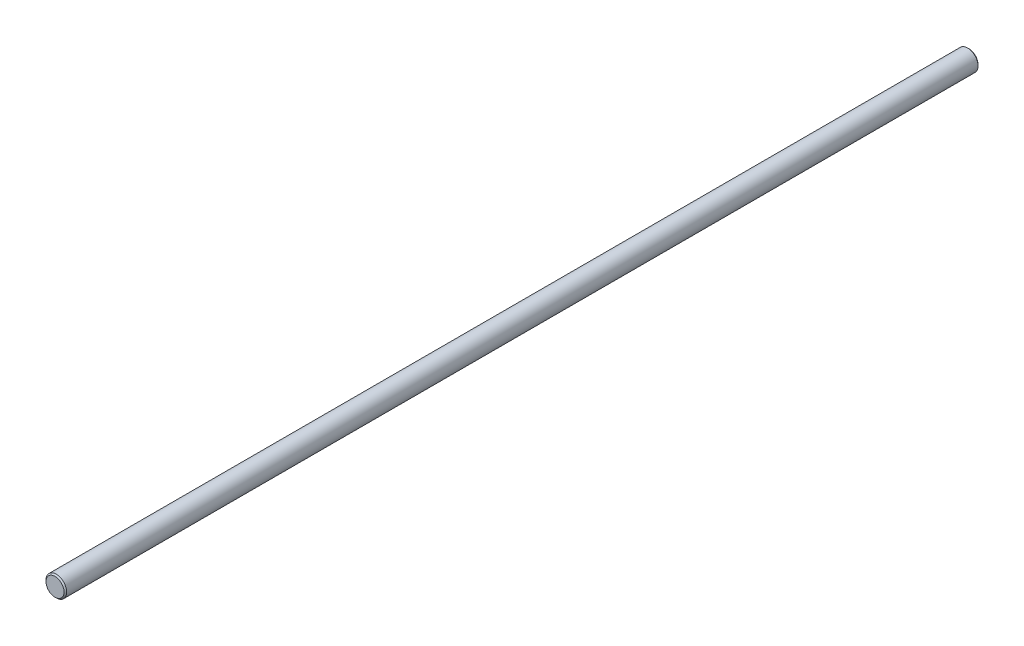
SolidWorks part; units mm, degrees
ref_plane "Спереди" through (0, 0, 0) normal (0, 0, 1) x (1, 0, 0)
ref_plane "Сверху" through (0, 0, 0) normal (0, 1, 0) x (1, 0, 0)
ref_plane "Справа" through (0, 0, 0) normal (1, 0, 0) x (0, 0, -1)
sketch "Эскиз1" plane through (0, 0, 0) normal (0, 1, 0) x (1, 0, 0)
  line L0 (4, 177) -> (0, 177)
  line L1 (0, 177) -> (0, -177)
  line L2 (0, -177) -> (4, -177)
  line L3 (0, 201.056) -> (0, 0) construction
  line L4 (4, -177) -> (4, 177)
  line L5 (0, 0) -> (40.1538, 0) construction
  line L6 (0, 177) -> (0, -177) construction
  point P7 (0, 0)
  dimension "D1" = 354
  dimension "D2" = 8
revolve "Повернуть1" add sketch "Эскиз1" angle 360 about L6
chamfer "Фаска1" distance 0.5 angle 45 2 edges at (4, 0, 177) (4, 0, -177)
